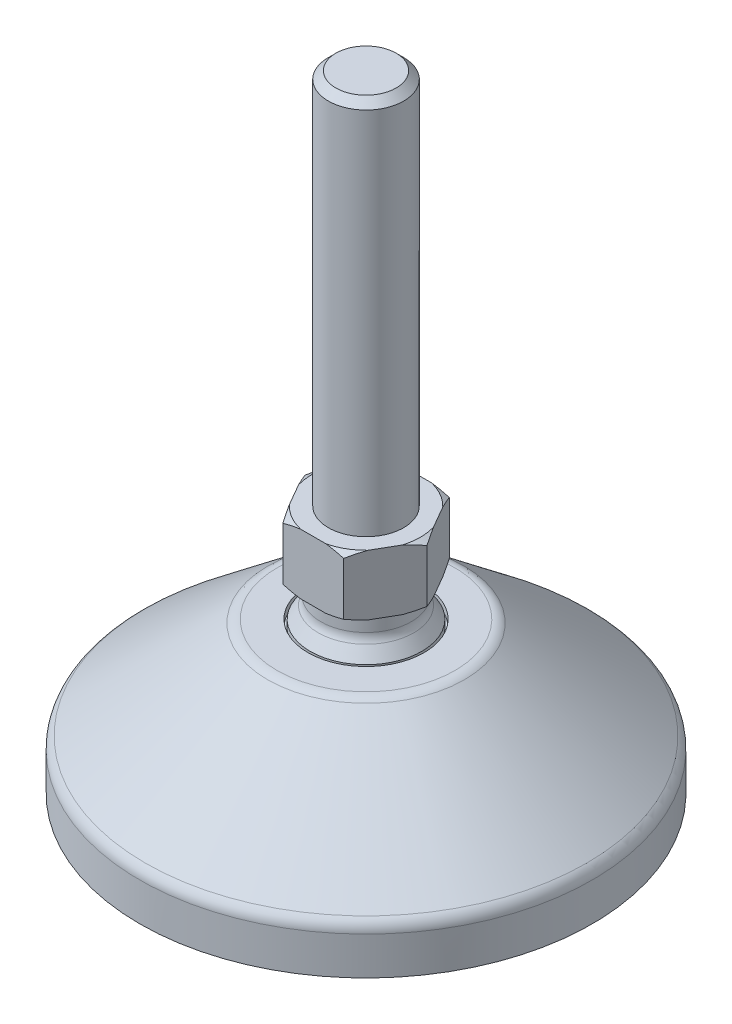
SolidWorks part; units mm, degrees
ref_plane "Front Plane" through (0, 0, 0) normal (0, 0, 1) x (1, 0, 0)
ref_plane "Top Plane" through (0, 0, 0) normal (0, 1, 0) x (1, 0, 0)
ref_plane "Right Plane" through (0, 0, 0) normal (1, 0, 0) x (0, 0, -1)
sketch "Sketch1" plane through (0, 0, 0) normal (0, 1, 0) x (1, 0, 0)
  circle A1 centre (0, 0) radius 25.75
  dimension "D1" = 51.5
extrude "Boss-Extrude1" add sketch "Sketch1" along normal blind 2
sketch "Sketch2" plane through (0, 2, 0) normal (0, 1, 0) x (1, 0, 0)
  circle A0 centre (0, 0) radius 30
  dimension "D1" = 60
extrude "Boss-Extrude2" add sketch "Sketch2" along normal blind 6
ref_plane "Plane1" through (0, 22, 0) normal (0, 1, 0) x (1, 0, 0)
sketch "Sketch3" plane through (0, 22, 0) normal (0, 1, 0) x (1, 0, 0)
  circle A0 centre (0, 0) radius 12.5
  dimension "D1" = 25
loft "Loft1" add profiles "Sketch3"
ref_plane "Plane2" through (0, 24.1, 0) normal (0, 1, 0) x (1, 0, 0)
sketch "Sketch4" plane through (0, 22, 0) normal (0, 1, 0) x (1, 0, 0)
  circle A0 centre (0, 0) radius 7.4
  dimension "D1" = 14.8
sketch "Sketch5" plane through (0, 24.1, 0) normal (0, 1, 0) x (1, 0, 0)
  circle A0 centre (0, 0) radius 6
  dimension "D1" = 12
loft "Loft2" add profiles "Sketch4", "Sketch5"
sketch "Sketch11" plane through (0, 22, 0) normal (0, 1, 0) x (1, 0, 0)
  circle A0 centre (0, 0) radius 7.4 construction
  circle A1 centre (0, 0) radius 7.4
  circle A2 centre (0, 0) radius 7.7
  dimension "D1" = 0.3
extrude "Cut-Extrude1" cut sketch "Sketch11" against normal blind 1
sketch "Sketch6" plane through (0, 24.1, 0) normal (0, 1, 0) x (1, 0, 0)
  circle A1 centre (0, 0) radius 6
  circle A2 centre (0, 0) radius 6
  dimension "D1" = 0
extrude "Boss-Extrude3" add sketch "Sketch6" along normal blind 2.9
sketch "Sketch7" plane through (0, 27, 0) normal (0, 1, 0) x (1, 0, 0)
  circle A0 centre (0, 0) radius 5
  dimension "D1" = 10
extrude "Boss-Extrude4" add sketch "Sketch7" along normal blind 58
sketch "Sketch8" plane through (0, 27, 0) normal (0, 1, 0) x (1, 0, 0)
  line L1 (8.0829, 0) -> (4.0415, 7)
  line L2 (4.0415, 7) -> (-4.0415, 7)
  line L3 (-4.0415, 7) -> (-8.0829, 0)
  line L4 (-8.0829, 0) -> (-4.0415, -7)
  line L5 (-4.0415, -7) -> (4.0415, -7)
  line L6 (4.0415, -7) -> (8.0829, 0)
  circle A0 centre (0, 0) radius 7 construction
  circle A1 centre (0, 0) radius 5 construction
  circle A2 centre (0, 0) radius 5
  dimension "D1" = 14
extrude "Boss-Extrude5" add sketch "Sketch8" along normal blind 8
sketch "Sketch9" plane through (0, 0, 0) normal (0, 0, 1) x (1, 0, 0)
  line L0 (-7.2, 35) -> (-8.0829, 34.5)
  line L1 (-8.0829, 35) -> (-4.0415, 35) construction
  line L2 (-8.0829, 35) -> (-8.0829, 27) construction
  line L3 (-8.0829, 27.5) -> (-7.2, 27)
  line L4 (-8.0829, 27) -> (-4.0415, 27) construction
  line L5 (-7.2, 35) -> (-7.2, 27) construction
  line L6 (0, -33) -> (0, 33) construction
  line L7 (-8.0829, 27.5) -> (-8.0829, 27)
  line L8 (-8.0829, 27) -> (-7.2, 27)
  line L9 (-7.2, 35) -> (-8.0829, 35)
  line L10 (-8.0829, 35) -> (-8.0829, 34.5)
  dimension "D1" = 7.2
  dimension "D2" = 0.5
  dimension "D3" = 0.5
revolve "Cut-Revolve1" cut sketch "Sketch9" angle 360 about axis through (0, 85, 0) along (0, -1, 0)
chamfer "Chamfer1" distance 1 angle 45 1 edges at (0, 85, 5)
sketch "Sketch10" plane through (0, 0, 0) normal (0, -1, 0) x (1, 0, 0)
  line L0 (3, 6) -> (20.6458, 6)
  line L2 (-3, -21.2897) -> (-3, -6)
  line L4 (3, -21.2897) -> (3, -6)
  line L5 (-3, -21.2897) -> (3, 21.2897) construction
  line L6 (-3, 21.2897) -> (3, -21.2897) construction
  line L7 (-20.6458, -6) -> (-3, -6)
  line L9 (-20.6458, 6) -> (-3, 6)
  line L11 (-20.6458, -6) -> (20.6458, 6) construction
  line L12 (-20.6458, 6) -> (20.6458, -6) construction
  line L13 (3, 6) -> (3, 21.2897)
  line L14 (-3, 6) -> (-3, 21.2897)
  line L15 (3, -6) -> (20.6458, -6)
  arc A0 (-20.6458, -6) -> (-3, -21.2897) centre (0, 0) ccw
  arc A1 (20.6458, 6) -> (3, 21.2897) centre (0, 0) ccw
  arc A2 (-3, 21.2897) -> (-20.6458, 6) centre (0, 0) ccw
  arc A3 (3, -21.2897) -> (20.6458, -6) centre (0, 0) ccw
  dimension "D1" = 43
  dimension "D2" = 6
  dimension "D3" = 12
extrude "Boss-Extrude6" add sketch "Sketch10" along normal blind 1
fillet "Fillet1" radius 2 2 edges at (0, 8, 30) (0, 22, 12.5)
fillet "Fillet2" radius 2 1 edges at (0, 24.1, 6)
fillet "Fillet3" radius 1 12 edges at (3, -0.5, -21.2897) (3, -0.5, -6) (20.6458, -0.5, -6) (20.6458, -0.5, 6) (3, -0.5, 21.2897) (3, -0.5, 6) (-3, -0.5, 21.2897) (-3, -0.5, 6) (-20.6458, -0.5, 6) (-20.6458, -0.5, -6) (-3, -0.5, -21.2897) (-3, -0.5, -6)
